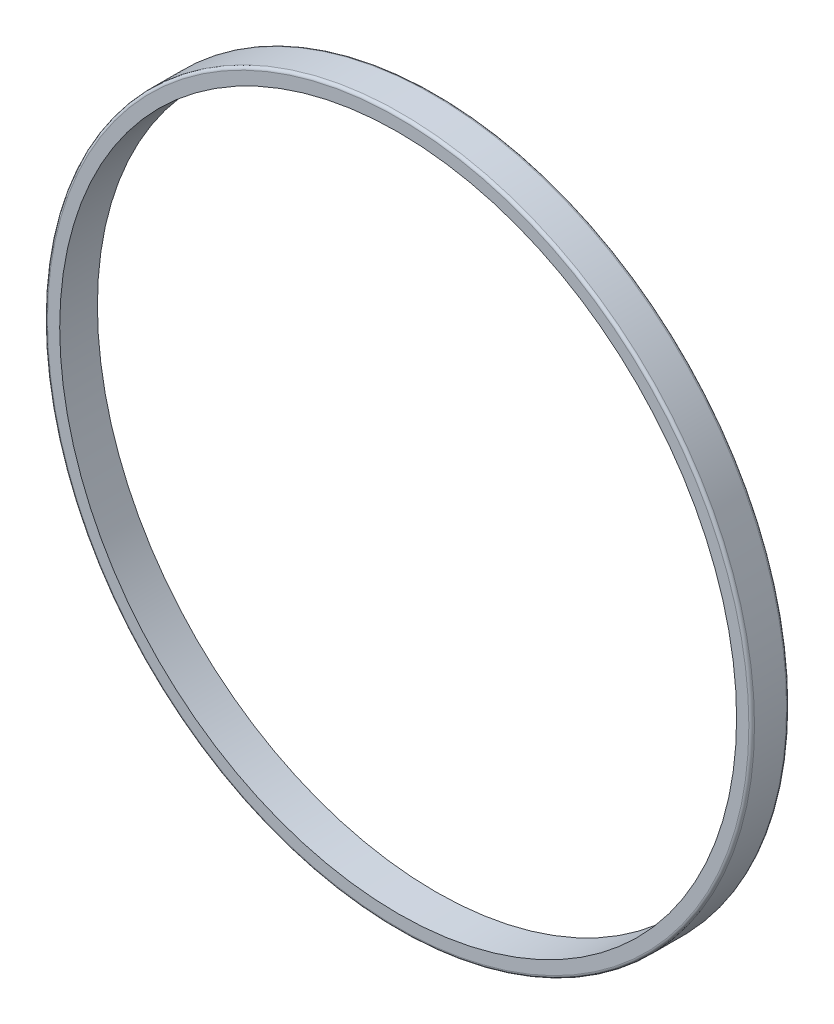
SolidWorks part; units mm, degrees
ref_plane "前视基准面" through (0, 0, 0) normal (0, 0, 1) x (1, 0, 0)
ref_plane "上视基准面" through (0, 0, 0) normal (0, 1, 0) x (1, 0, 0)
ref_plane "右视基准面" through (0, 0, 0) normal (1, 0, 0) x (0, 0, -1)
sketch "草图1" plane through (0, 0, 0) normal (0, 0, 1) x (1, 0, 0)
  circle A0 centre (0, 0) radius 37.5
  circle A1 centre (0, 0) radius 35.9
  dimension "D1" = 75
  dimension "D2" = 1.6
extrude "凸台-拉伸1" add sketch "草图1" along normal blind 4
fillet "圆角1" radius 0.3 2 edges at (37.5, 0, 0) (37.5, 0, 4)
